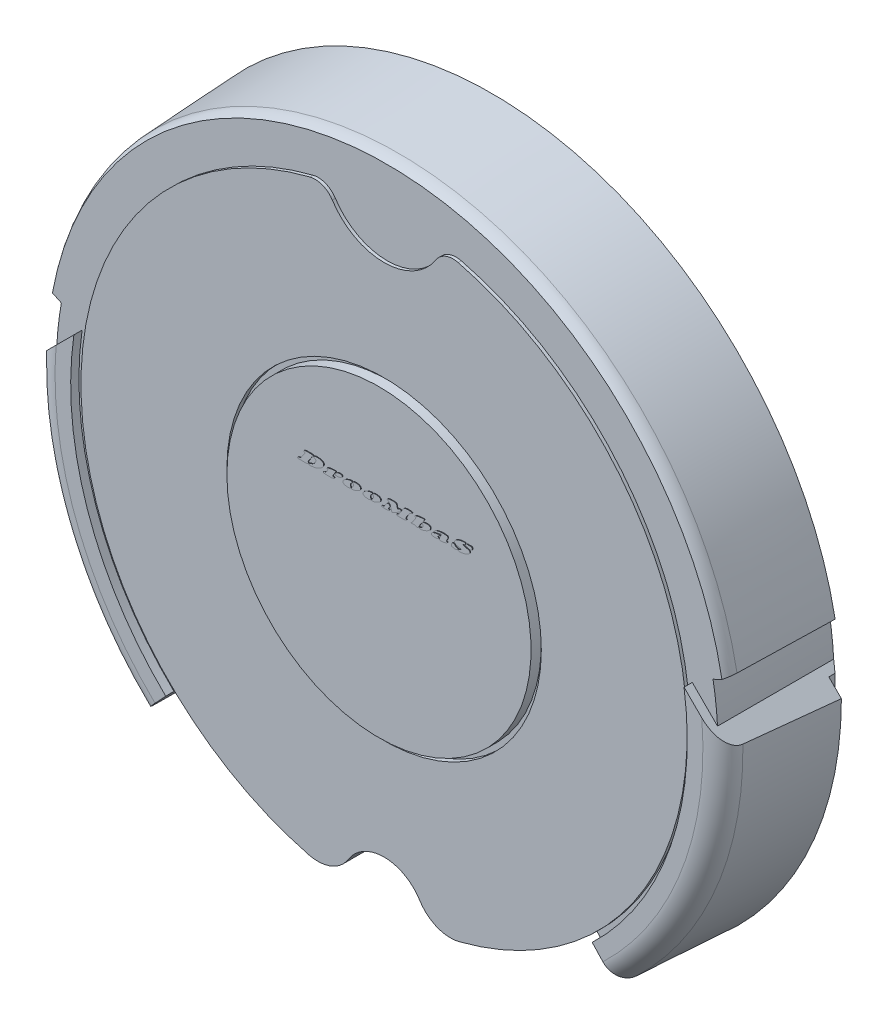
SolidWorks part; units mm, degrees
ref_plane "Plan de face" through (0, 0, 0) normal (0, 0, 1) x (1, 0, 0)
ref_plane "Plan de dessus" through (0, 0, 0) normal (0, 1, 0) x (1, 0, 0)
ref_plane "Plan de droite" through (0, 0, 0) normal (1, 0, 0) x (0, 0, -1)
sketch "Esquisse1" plane through (0, 0, 0) normal (0, 0, 1) x (1, 0, 0)
  circle A0 centre (0, 0) radius 170
  dimension "D1" = 340
extrude "Extrusion1" add sketch "Esquisse1" along normal blind 55 draft 3
fillet "Congé1" radius 10 1 edges at (167.1176, 0, 55)
sketch "Esquisse2" plane through (0, 0, 0) normal (0, 0, -1) x (-1, 0, 0)
  circle A0 centre (0, 0) radius 164
  dimension "D1" = 328
extrude "Extrusion2" add sketch "Esquisse2" along normal blind 11
chamfer "Chanfrein1" distance 8 angle 50 1 edges at (-164, 0, -11)
sketch "Esquisse3" plane through (0, 0, -11) normal (0, 0, -1) x (-1, 0, 0)
  line L0 (-213.4113, 0) -> (216.0624, 0) construction
  line L1 (0, 171.6527) -> (0, -190.8814) construction
  line L2 (-115.5, -116.4292) -> (-115.5, -44.4292)
  line L3 (115.5, -116.4292) -> (115.5, -44.4292)
  line L4 (-115.5, -44.4292) -> (-108, -44.4292)
  line L5 (-108, -44.4292) -> (-108, 40.5708)
  line L6 (-108, 40.5708) -> (108, 40.5708)
  line L7 (115.5, -44.4292) -> (108, -44.4292)
  line L8 (108, -44.4292) -> (108, 40.5708)
  line L9 (-115.5, -116.4292) -> (-119.7256, -120.6888)
  line L10 (-119.7256, -120.6888) -> (0, 0) construction
  line L11 (115.5, -116.4292) -> (119.7256, -120.6888)
  circle A1 centre (0, 0) radius 164 construction
  circle A2 centre (0, 0) radius 164 construction
  circle A3 centre (0, 0) radius 170 construction
  arc A4 (-119.7256, -120.6888) -> (119.7256, -120.6888) centre (0, 0) ccw
  point P18 (0, 40.5708)
  dimension "D1" = 231
  dimension "D2" = 72
  dimension "D3" = 7.5
  dimension "D4" = 85
  dimension "D5" = 45.23
extrude "Enlèv. mat.-Extru.1" cut sketch "Esquisse3" against normal blind 48
sketch "Esquisse4" plane through (0, 0, -11) normal (0, 0, -1) x (-1, 0, 0)
  line L0 (0, -135.441) -> (0, 130.1312) construction
  line L1 (-56.014, 0) -> (56.014, 0) construction
  line L2 (-154, -41.5241) -> (-108, -41.5241)
  line L5 (-108, -41.5241) -> (-108, 40.5708)
  line L6 (-156.7527, 29.4759) -> (-154.2082, 29.4759)
  line L7 (-137.1147, 76.4759) -> (-76.6147, 76.4759)
  line L8 (-76.6147, 76.4759) -> (-76.6147, 40.5708)
  line L10 (-108, 40.5708) -> (-76.6147, 40.5708)
  line L11 (76.6147, 40.5708) -> (108, 40.5708)
  line L12 (76.6147, 76.4759) -> (76.6147, 40.5708)
  line L13 (137.1147, 76.4759) -> (76.6147, 76.4759)
  line L14 (156.7527, 29.4759) -> (154.2082, 29.4759)
  line L15 (108, 40.5708) -> (108, -41.5241)
  line L16 (154, -41.5241) -> (108, -41.5241)
  arc A0 (-156.7527, 29.4759) -> (-154, -41.5241) centre (0, 0) ccw
  arc A1 (-137.1147, 76.4759) -> (-154.2082, 29.4759) centre (0, 0) ccw
  arc A2 (137.1147, 76.4759) -> (154.2082, 29.4759) centre (0, 0) cw
  arc A3 (156.7527, 29.4759) -> (154, -41.5241) centre (0, 0) cw
  dimension "D1" = 319
  dimension "D3" = 314
  dimension "D2" = 46
  dimension "D4" = 41.5241
  dimension "D6" = 60.5
extrude "Enlèv. mat.-Extru.2" cut sketch "Esquisse4" against normal blind 57
sketch "Esquisse5" plane through (0, 0, -11) normal (0, 0, -1) x (-1, 0, 0)
  line L0 (0, -18.1411) -> (0, 128.1543) construction
  line L1 (67.9, 44.5708) -> (-67.9, 44.5708)
  line L2 (-67.9, 44.5708) -> (-67.9, 89.5708)
  line L3 (-67.9, 89.5708) -> (67.9, 89.5708)
  line L4 (76.6147, 40.5708) -> (-76.6147, 40.5708) construction
  line L5 (67.9, 44.5708) -> (67.9, 89.5708)
  point P10 (0, 89.5708)
  point P11 (0, 44.5708)
  dimension "D1" = 45
  dimension "D2" = 67.9
  dimension "D3" = 4
extrude "Enlèv. mat.-Extru.3" cut sketch "Esquisse5" against normal blind 57.8
sketch "Esquisse6" plane through (0, 0, 0) normal (0, 1, 0) x (1, 0, 0)
  line L0 (0, 0) -> (0, -87.5538) construction
  line L1 (-74, -50) -> (-76.5, -50)
  line L2 (-147.5, -52.5) -> (-147.5, -51)
  line L3 (-147.5, -51) -> (-150, -51)
  line L4 (-150, -51) -> (-150, -55)
  line L5 (-150, -55) -> (-74, -55)
  line L6 (-74, -55) -> (-74, -50)
  line L7 (-157.6279, -55) -> (157.6279, -55) construction
  line L8 (-76.5, -50) -> (-76.5, -52.5)
  line L9 (-147.5, -52.5) -> (-76.5, -52.5)
  dimension "D1" = 2.5
  dimension "D2" = 4
  dimension "D3" = 5
  dimension "D4" = 150
  dimension "D5" = 74
  dimension "D6" = 2.5
  dimension "D7" = 2.5
revolve "Enlèvement de matière-Révolution1" cut sketch "Esquisse6" angle 360 about L0
sketch "Esquisse7" plane through (0, 0, 55) normal (0, 0, 1) x (1, 0, 0)
  line L0 (-228.0099, 0) -> (266.2312, 0) construction
  line L1 (0, 180.2522) -> (0, -180.2522) construction
  line L2 (170, 0) -> (160.7331, 9.2669)
  line L3 (0, 0) -> (233.5081, 41.1738) construction
  line L4 (100, 0) -> (218.9608, 56.7993) construction
  line L5 (158.554, 27.9574) -> (182.9192, 39.5908)
  line L6 (182.9192, 39.5908) -> (170, 0)
  arc A0 (160.7331, 9.2669) -> (158.554, 27.9574) centre (0, 0) ccw
  arc A1 (119.7256, -120.6888) -> (-119.7256, -120.6888) centre (0, 0) ccw construction
  dimension "D1" = 161
  dimension "D2" = 45
  dimension "D3" = 10
  dimension "D4" = 100
  dimension "D5" = 27
extrude "Enlèv. mat.-Extru.4" cut sketch "Esquisse7" against normal through all
mirror "Symétrie1" about plane through (0, 0, 0) normal (1, 0, 0) of "Enlèv. mat.-Extru.4"
sketch "Esquisse8" plane through (0, 0, 55) normal (0, 0, 1) x (1, 0, 0)
  line L0 (-199.0144, 0) -> (274.1391, 0) construction
  line L1 (170, 0) -> (145.4411, 24.5589)
  line L2 (0, -187.8701) -> (0, 229.6648) construction
  line L3 (-170, 0) -> (-145.4411, 24.5589)
  circle A0 centre (0, 0) radius 147.5 construction
  arc A1 (145.4411, 24.5589) -> (-145.4411, 24.5589) centre (0, 0) ccw
  arc A2 (170, 0) -> (-170, 0) centre (0, 0) ccw
  arc A3 (166.9661, 31.9738) -> (-166.9661, 31.9738) centre (0, 0) ccw construction
  dimension "D1" = 45
extrude "Enlèv. mat.-Extru.5" cut sketch "Esquisse8" against normal blind 4
sketch "Esquisse9" plane through (0, 0, 55) normal (0, 0, 1) x (1, 0, 0)
  line L0 (-133.7746, 0) -> (115.3229, 0) construction
  line L1 (0, -233.0488) -> (0, 40.4313) construction
  line L2 (0, 0) -> (165.7266, -177.72) construction
  line L3 (102.0482, -106.5008) -> (126.943, -133.1971)
  line L4 (-102.0482, -106.5008) -> (-126.943, -133.1971)
  line L5 (0, 0) -> (-185.1472, -198.5461) construction
  arc A0 (17.408, -135.1736) -> (-17.408, -135.1736) centre (0, -146) ccw
  circle A2 centre (0, 0) radius 147.5 construction
  arc A3 (36.6123, -142.8838) -> (102.0482, -106.5008) centre (0, 0) ccw
  arc A4 (17.408, -135.1736) -> (36.6123, -142.8838) centre (32.2685, -125.9315) ccw
  arc A5 (-36.6123, -142.8838) -> (-17.408, -135.1736) centre (-32.2685, -125.9315) ccw
  arc A6 (-126.943, -133.1971) -> (125.4877, -134.5691) centre (0, 0) ccw
  arc A7 (-102.0482, -106.5008) -> (-36.6123, -142.8838) centre (0, 0) ccw
  dimension "D2" = 41
  dimension "D3" = 17.5
  dimension "D6" = 184
  dimension "D1" = 146
  dimension "D4" = 43
  dimension "D5" = 2
  dimension "D7" = 43
extrude "Enlèv. mat.-Extru.6" cut sketch "Esquisse9" against normal through all and the other way through all
sketch "Esquisse10" plane through (0, 0, 52.5) normal (0, 0, 1) x (1, 0, 0)
  line L0 (0, 0) -> (0, 178.8592) construction
  circle A0 centre (0, 155) radius 30
  dimension "D1" = 60
  dimension "D2" = 155
extrude "Enlèv. mat.-Extru.7" cut sketch "Esquisse10" against normal up to surface (1.5 mm away)
fillet "Congé2" radius 10 1 edges at (28.2049, 144.7782, 51.75)
sketch "Esquisse11" plane through (0, 0, 55) normal (0, 0, 1) x (1, 0, 0)
  text T0 "<i><b>DrooMbaS</b></i>" font "ELLIS" height in points 20
extrude "Extrusion3" add sketch "Esquisse11" along normal blind 0.3
sketch "Esquisse12" plane through (0, 0, -11) normal (0, 0, -1) x (-1, 0, 0)
  line L0 (-76.6147, 76.4759) -> (-137.1147, 76.4759) construction
  line L1 (-76.6147, 40.5708) -> (-76.6147, 76.4759) construction
  line L2 (-116.6147, 79.4759) -> (-62.6147, 79.4759)
  line L3 (-62.6147, 79.4759) -> (-62.6147, 118.675)
  line L4 (-62.6147, 118.675) -> (-105.8484, 118.675)
  line L5 (-105.8484, 118.675) -> (-123.7236, 109.8099)
  arc A0 (-123.7236, 109.8099) -> (-116.6147, 79.4759) centre (-116.6147, 95.4759) ccw
  dimension "D1" = 32
  dimension "D2" = 19
  dimension "D3" = 40
  dimension "D4" = 54
extrude "Enlèv. mat.-Extru.8" cut sketch "Esquisse12" against normal blind 52
ref_plane "Plan1" through (0, 0, -5) normal (0, 0, -1) x (-1, 0, 0)
sketch "Esquisse13" plane through (0, 0, -5) normal (0, 0, -1) x (-1, 0, 0)
  circle A0 centre (-116.6147, 95.4759) radius 40
  dimension "D1" = 80
extrude "Enlèv. mat.-Extru.9" cut sketch "Esquisse13" along normal through all
sketch "Esquisse14" plane through (0, 0, -11) normal (0, 0, -1) x (-1, 0, 0)
  line L0 (0, 0) -> (0, 176.4153) construction
  circle A0 centre (0, 138) radius 23.5
  dimension "D1" = 47
  dimension "D2" = 138
extrude "Enlèv. mat.-Extru.10" cut sketch "Esquisse14" against normal blind 10
